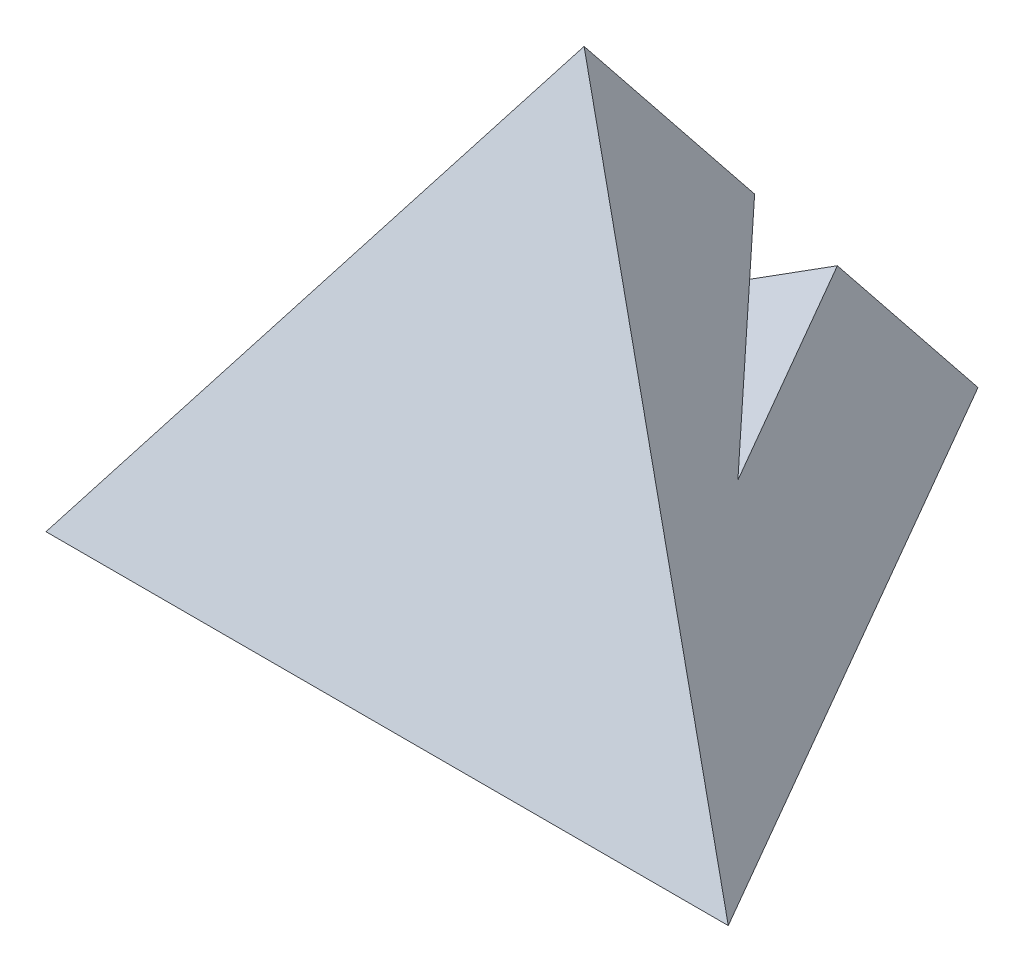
SolidWorks part; units mm, degrees
ref_plane "前视基准面" through (0, 0, 0) normal (0, 0, 1) x (1, 0, 0)
ref_plane "上视基准面" through (0, 0, 0) normal (0, 1, 0) x (1, 0, 0)
ref_plane "右视基准面" through (0, 0, 0) normal (1, 0, 0) x (0, 0, -1)
sketch "草图1" plane through (0, 0, 0) normal (0, 1, 0) x (1, 0, 0)
  line L1 (0, 1524) -> (-1319.8227, -762)
  line L2 (-1319.8227, -762) -> (1319.8227, -762)
  line L3 (1319.8227, -762) -> (0, 1524)
  circle A0 centre (0, 0) radius 762 construction
  dimension "D1" = 1524
sketch "草图2" plane through (0, 0, 0) normal (1, 0, 0) x (0, 0, -1)
  line L0 (1524, 0) -> (-762, 0) construction
  point P0 (0, 1905)
  dimension "D1" = 1905
loft "放样1" add profiles "草图2", "草图1"
sketch "草图3" plane through (0, 0, 0) normal (1, 0, 0) x (0, 0, -1)
  line L0 (69.2284, 680.128) -> (1121.0294, 1392.7489)
  line L1 (69.2284, 680.128) -> (1338.7746, 680.128)
  line L2 (1338.7746, 680.128) -> (1121.0294, 1392.7489)
  point P2 (69.2284, 680.128)
extrude "切除-拉伸1" cut sketch "草图3" against normal through all both and the other way through all
